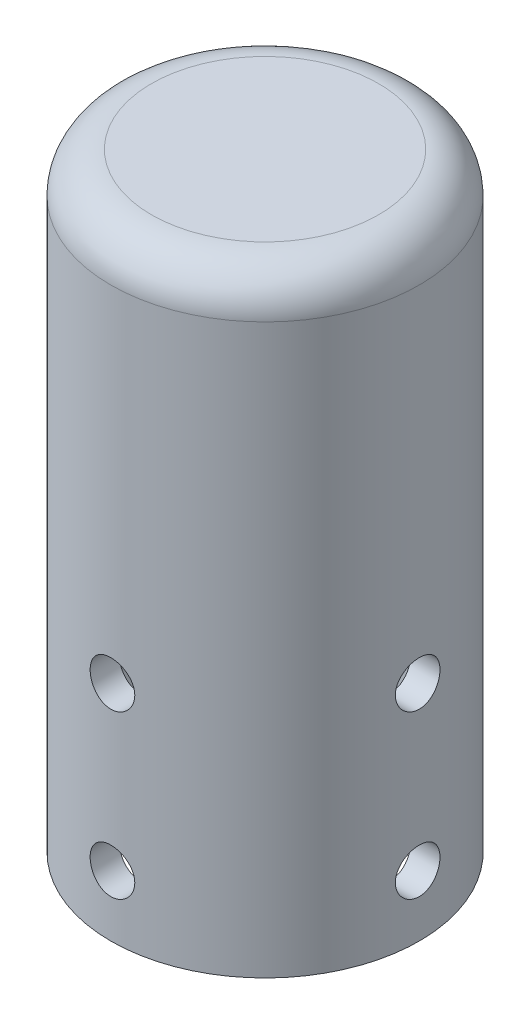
SolidWorks part; units mm, degrees
ref_plane "Plan de face" through (0, 0, 0) normal (0, 0, 1) x (1, 0, 0)
ref_plane "Plan de dessus" through (0, 0, 0) normal (0, 1, 0) x (1, 0, 0)
ref_plane "Plan de droite" through (0, 0, 0) normal (1, 0, 0) x (0, 0, -1)
sketch "Esquisse1" plane through (0, 0, 0) normal (0, 1, 0) x (1, 0, 0)
  circle A0 centre (0, 0) radius 38
  dimension "D1" = 76
extrude "Extrusion1" add sketch "Esquisse1" along normal blind 150
fillet "Congé1" radius 10 1 edges at (0, 150, 38)
sketch "Esquisse2" plane through (0, 0, 0) normal (0, -1, 0) x (1, 0, 0)
  circle A0 centre (0, 0) radius 31
  dimension "D1" = 62
extrude "Extrusion2" cut sketch "Esquisse2" against normal blind 140
fillet "Congé2" radius 10 1 edges at (0, 140, -31)
hole_wizard "Dégagement M101" positions "Esquisse3D1" profile "Esquisse3" hole size "M10" standard "ISO"
sketch3d "Esquisse3D1"
  point P0 (0, 15, 38)
  point P2 (0, 55, 38)
  dimension "D1" = 15
  dimension "D2" = 40
sketch "Esquisse3" plane through (0, 15, 38) normal (1, 0, 0) x (0, -1, 0)
  line L0 (0, 0) -> (0, 69.001)
  line L1 (0, 69.001) -> (5.5, 69.001)
  line L2 (5.5, 69.001) -> (5.5, 0)
  line L5 (5.5, 0) -> (0, 0)
  line L11 (0, -6.35) -> (0, 107.95) construction
  dimension "Diamètre du perçage jusqu'au prochain" = 11
  dimension "Profondeur du perçage jusqu'au prochain" = 69.001
pattern_circular "Répétition circulaire1" count 4 over 360 about axis through (0, 150, 0) along (0, -1, 0) of "Dégagement M101"
